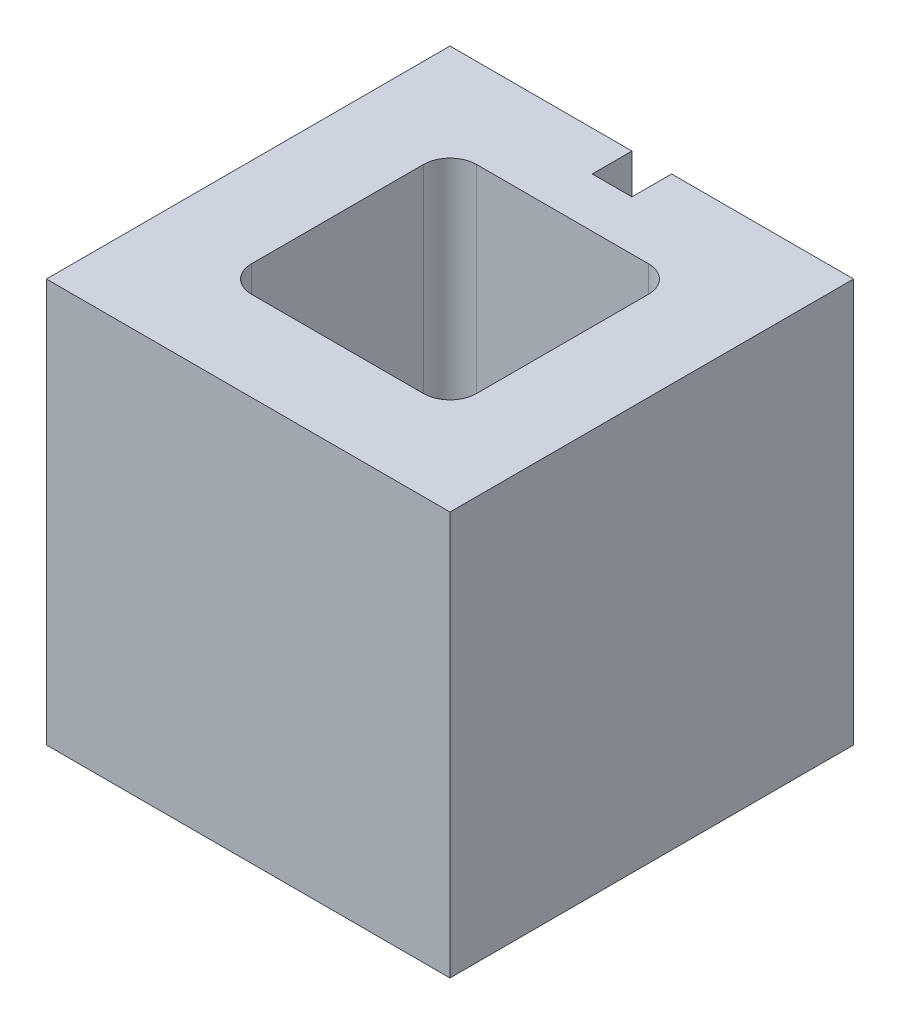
SolidWorks part; units mm, degrees
ref_plane "Front Plane" through (0, 0, 0) normal (0, 0, 1) x (1, 0, 0)
ref_plane "Top Plane" through (0, 0, 0) normal (0, 1, 0) x (1, 0, 0)
ref_plane "Right Plane" through (0, 0, 0) normal (1, 0, 0) x (0, 0, -1)
sketch "Sketch1" plane through (0, 0, 0) normal (0, 1, 0) x (1, 0, 0)
  line L1 (0, 0) -> (193.675, 0)
  line L2 (0, 0) -> (0, 193.675)
  line L3 (0, 193.675) -> (193.675, 193.675)
  line L4 (193.675, 0) -> (193.675, 193.675)
  dimension "D1" = 193.675
extrude "Extrude1" add sketch "Sketch1" along normal blind 193.675
sketch "Sketch2" plane through (0, 193.675, 0) normal (0, 1, 0) x (1, 0, 0)
  line L0 (96.8375, 199.5716) -> (96.8375, -10.4377) construction
  line L1 (-21.2239, 96.8375) -> (216.1924, 96.8375) construction
  line L2 (0, 193.675) -> (0, 0) construction
  line L3 (0, 0) -> (193.675, 0) construction
  line L4 (193.675, 193.675) -> (0, 193.675) construction
  line L5 (42.8625, 150.8125) -> (150.8125, 150.8125)
  line L6 (42.8625, 150.8125) -> (42.8625, 42.8625)
  line L7 (42.8625, 42.8625) -> (150.8125, 42.8625)
  line L8 (150.8125, 150.8125) -> (150.8125, 42.8625)
  line L9 (87.3125, 193.675) -> (106.3625, 193.675)
  line L10 (87.3125, 193.675) -> (87.3125, 174.625)
  line L11 (87.3125, 174.625) -> (106.3625, 174.625)
  line L12 (106.3625, 193.675) -> (106.3625, 174.625)
  point P6 (0, 96.8375)
  point P9 (96.8375, 0)
  dimension "D1" = 107.95
  dimension "D2" = 19.05
extrude "Cut-Extrude1" cut sketch "Sketch2" against normal up to next
fillet "Fillet1" radius 12.7 4 edges at (42.8625, 96.8375, -42.8625) (150.8125, 96.8375, -42.8625) (150.8125, 96.8375, -150.8125) (42.8625, 96.8375, -150.8125)
